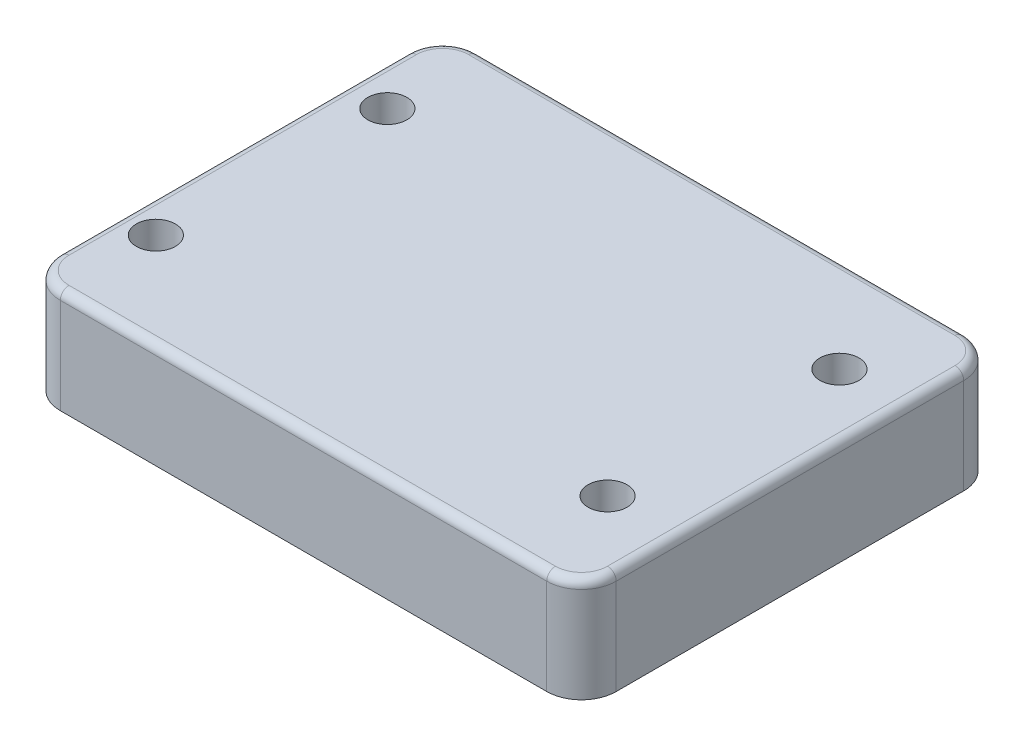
SolidWorks part; units mm, degrees
ref_plane "Front Plane" through (0, 0, 0) normal (0, 0, 1) x (1, 0, 0)
ref_plane "Top Plane" through (0, 0, 0) normal (0, 1, 0) x (1, 0, 0)
ref_plane "Right Plane" through (0, 0, 0) normal (1, 0, 0) x (0, 0, -1)
sketch "Sketch1"
  dimension "D1" = 107.95
  dimension "D2" = 76.2
extrude "Extrude1" add sketch "Sketch1" along normal blind 19.05
fillet "Fillet1" radius 6.35 4 edges at (107.95, 9.525, -76.2) (107.95, 9.525, 0) (6.35, 9.525, -76.2) (6.35, 9.525, 0)
fillet "Fillet2" radius 1.5875 8 edges at (106.0901, 19.05, -1.8599) (57.15, 19.05, 0) (8.2099, 19.05, -1.8599) (6.35, 19.05, -38.1) (8.2099, 19.05, -74.3401) (57.15, 19.05, -76.2) (106.0901, 19.05, -74.3401) (107.95, 19.05, -38.1)
sketch "Sketch2"
extrude "Cut-Extrude1" cut sketch "Sketch2" against normal through all
